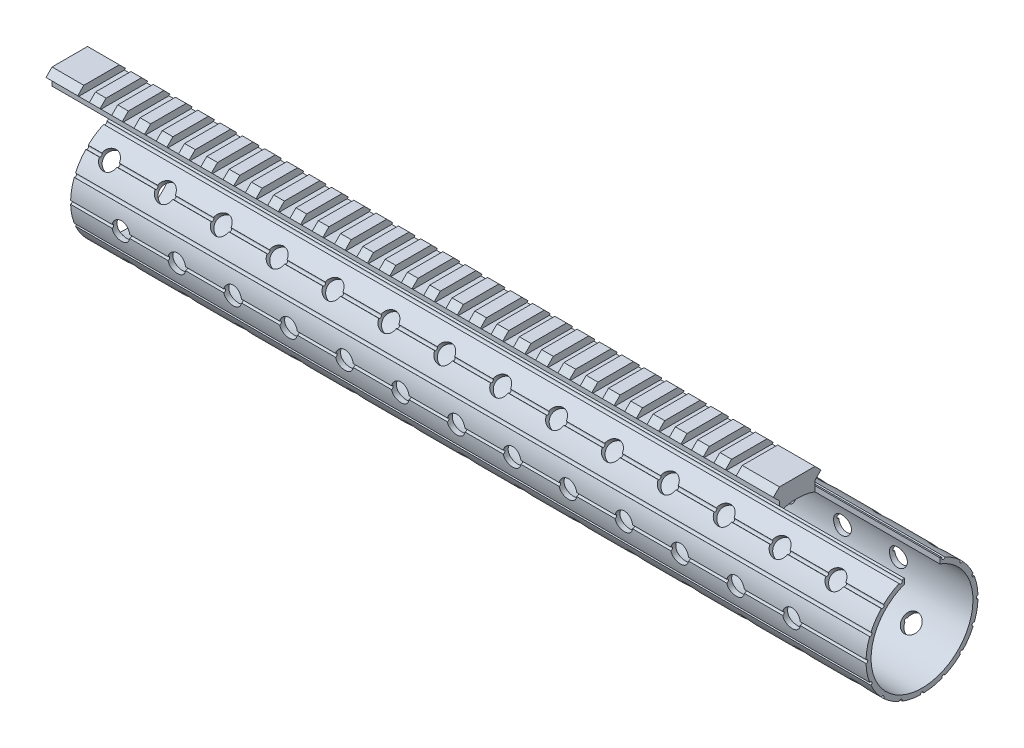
SolidWorks part; units mm, degrees
ref_plane "Front Plane" through (0, 0, 0) normal (0, 0, 1) x (1, 0, 0)
ref_plane "Top Plane" through (0, 0, 0) normal (0, 1, 0) x (1, 0, 0)
ref_plane "Right Plane" through (0, 0, 0) normal (1, 0, 0) x (0, 0, -1)
sketch "Sketch2" plane through (0, 0, 0) normal (0, 0, 1) x (1, 0, 0)
  line L0 (0, 0) -> (20.32, 0) construction
  line L1 (0, 0) -> (462.7626, 0) construction
  line L2 (0, 0) -> (20.32, 0)
  line L3 (0, 0) -> (0, 25.0571)
  line L4 (0, 25.0571) -> (360, 25.0571)
  line L5 (462.7626, 15.0339) -> (462.7626, 17.2945)
  line L6 (360, 25.0571) -> (367.7626, 17.2945)
  line L7 (367.7626, 17.2945) -> (462.7626, 17.2945)
  line L8 (20.32, 0) -> (20.32, 22.7965)
  line L9 (20.32, 22.7965) -> (360, 22.7965)
  line L10 (360, 22.7965) -> (367.7626, 15.0339)
  line L11 (367.7626, 15.0339) -> (462.7626, 15.0339)
  dimension "D1" = 225
  dimension "D2" = 360
  dimension "D3" = 95
revolve "Revolve1" add sketch "Sketch2" angle 360 about L1
fillet "Fillet1" radius 10 2 edges at (360, 0, 25.0571) (367.7626, 0, 17.2945)
sketch "Sketch3" plane through (0, 0, 0) normal (1, 0, 0) x (0, 0, -1)
  circle A1 centre (0, 0) radius 22.7965
  circle A2 centre (0, 0) radius 22.7965
  dimension "D1" = 0
extrude "Cut-Extrude2" cut sketch "Sketch3" along normal blind 25
sketch "Sketch4" plane through (0, 0, 0) normal (0, 0, 1) x (1, 0, 0)
  line L1 (355.8579, 25.0571) -> (470.1858, 25.0571)
  line L2 (355.8579, 25.0571) -> (355.8579, -32.5281)
  line L3 (355.8579, -32.5281) -> (470.1858, -32.5281)
  line L4 (470.1858, 25.0571) -> (470.1858, -32.5281)
extrude "Cut-Extrude4" cut sketch "Sketch4" against normal mid plane 55
sketch "Sketch5" plane through (0, 0, 0) normal (1, 0, 0) x (0, 0, -1)
  line L0 (-7.9375, 23.7667) -> (-7.9375, 25.781)
  line L1 (-7.9375, 25.781) -> (-10.6553, 28.4988)
  line L2 (-10.6553, 28.4988) -> (-7.9375, 31.2166)
  line L3 (-7.9375, 31.2166) -> (7.9375, 31.2166)
  line L4 (7.9375, 31.2166) -> (10.6553, 28.4988)
  line L5 (10.6553, 28.4988) -> (7.9375, 25.781)
  line L6 (7.9375, 25.781) -> (7.9375, 23.7667)
  line L7 (7.9375, 23.7667) -> (7.9375, 22.6778)
  line L8 (7.9375, 22.6778) -> (0, 23.541)
  line L9 (0, 23.541) -> (-7.9375, 22.4476)
  line L10 (-7.9375, 22.4476) -> (-7.9375, 23.7667)
extrude "Boss-Extrude1" add sketch "Sketch5" along normal blind 300
sketch "Sketch6" plane through (0, 0, 0) normal (1, 0, 0) x (0, 0, -1)
  line L0 (-7.9375, 25.781) -> (-7.9375, 23.7667) construction
  line L1 (-10.6553, 28.4988) -> (-7.9375, 25.781) construction
  line L2 (-7.9375, 31.2166) -> (-10.6553, 28.4988) construction
  line L3 (7.9375, 31.2166) -> (-7.9375, 31.2166) construction
  line L4 (10.6553, 28.4988) -> (7.9375, 31.2166) construction
  line L5 (7.9375, 25.781) -> (10.6553, 28.4988) construction
  line L6 (7.9375, 23.7667) -> (7.9375, 25.781) construction
  line L7 (-7.9375, 25.781) -> (-7.9375, 23.7667)
  line L8 (-10.6553, 28.4988) -> (-7.9375, 25.781)
  line L9 (-7.9375, 31.2166) -> (-10.6553, 28.4988)
  line L10 (7.9375, 31.2166) -> (-7.9375, 31.2166)
  line L11 (10.6553, 28.4988) -> (7.9375, 31.2166)
  line L12 (7.9375, 25.781) -> (10.6553, 28.4988)
  line L13 (7.9375, 23.7667) -> (7.9375, 25.781)
  arc A0 (7.9375, 23.7667) -> (-7.9375, 23.7667) centre (0, 0) ccw
extrude "Boss-Extrude2" add sketch "Sketch6" against normal blind 25.4
sketch "Sketch7" plane through (0, 0, 0) normal (0, 0, 1) x (1, 0, 0)
  line L0 (-11.2014, 28.4988) -> (-11.2014, 31.2166)
  line L1 (283.3624, 31.2166) -> (278.5999, 31.2166)
  line L2 (-1.2319, 28.4988) -> (-1.2319, 31.2166)
  line L3 (3.9751, 31.2166) -> (-1.2319, 31.2166)
  line L4 (-5.9944, 31.2166) -> (-5.9944, 28.4988)
  line L5 (8.7376, 28.4988) -> (8.7376, 31.2166)
  line L6 (13.9446, 31.2166) -> (8.7376, 31.2166)
  line L7 (3.9751, 31.2166) -> (3.9751, 28.4988)
  line L8 (18.7071, 28.4988) -> (18.7071, 31.2166)
  line L9 (23.9141, 31.2166) -> (18.7071, 31.2166)
  line L10 (13.9446, 31.2166) -> (13.9446, 28.4988)
  line L11 (283.3624, 31.2166) -> (278.5999, 31.2166)
  line L12 (153.5176, 28.4988) -> (153.5176, 28.0416)
  line L13 (153.5176, 28.0416) -> (148.3106, 28.0416)
  line L14 (148.3106, 28.0416) -> (148.3106, 28.4988)
  line L15 (143.5481, 28.4988) -> (143.5481, 28.0416)
  line L16 (143.5481, 28.0416) -> (138.3411, 28.0416)
  line L17 (138.3411, 28.0416) -> (138.3411, 28.4988)
  line L18 (133.5786, 28.4988) -> (133.5786, 28.0416)
  line L19 (133.5786, 28.0416) -> (128.3716, 28.0416)
  line L20 (128.3716, 28.0416) -> (128.3716, 28.4988)
  line L21 (123.6091, 28.4988) -> (123.6091, 28.0416)
  line L22 (123.6091, 28.0416) -> (118.4021, 28.0416)
  line L23 (118.4021, 28.0416) -> (118.4021, 28.4988)
  line L24 (113.6396, 28.4988) -> (113.6396, 28.0416)
  line L25 (113.6396, 28.0416) -> (108.4326, 28.0416)
  line L26 (108.4326, 28.0416) -> (108.4326, 28.4988)
  line L27 (103.6701, 28.4988) -> (103.6701, 28.0416)
  line L28 (103.6701, 28.0416) -> (98.4631, 28.0416)
  line L29 (98.4631, 28.0416) -> (98.4631, 28.4988)
  line L30 (93.7006, 28.4988) -> (93.7006, 28.0416)
  line L31 (93.7006, 28.0416) -> (88.4936, 28.0416)
  line L32 (88.4936, 28.0416) -> (88.4936, 28.4988)
  line L33 (83.7311, 28.4988) -> (83.7311, 28.0416)
  line L34 (83.7311, 28.0416) -> (78.5241, 28.0416)
  line L35 (78.5241, 28.0416) -> (78.5241, 28.4988)
  line L36 (73.7616, 28.4988) -> (73.7616, 28.0416)
  line L37 (73.7616, 28.0416) -> (68.5546, 28.0416)
  line L38 (68.5546, 28.0416) -> (68.5546, 28.4988)
  line L39 (63.7921, 28.4988) -> (63.7921, 28.0416)
  line L40 (63.7921, 28.0416) -> (58.5851, 28.0416)
  line L41 (58.5851, 28.0416) -> (58.5851, 28.4988)
  line L42 (53.8226, 28.4988) -> (53.8226, 28.0416)
  line L43 (53.8226, 28.0416) -> (48.6156, 28.0416)
  line L44 (48.6156, 28.0416) -> (48.6156, 28.4988)
  line L45 (43.8531, 28.4988) -> (43.8531, 28.0416)
  line L46 (43.8531, 28.0416) -> (38.6461, 28.0416)
  line L47 (38.6461, 28.0416) -> (38.6461, 28.4988)
  line L48 (33.8836, 28.4988) -> (33.8836, 28.0416)
  line L49 (33.8836, 28.0416) -> (28.6766, 28.0416)
  line L50 (28.6766, 28.0416) -> (28.6766, 28.4988)
  line L51 (23.9141, 28.4988) -> (23.9141, 28.0416)
  line L52 (23.9141, 28.0416) -> (18.7071, 28.0416)
  line L53 (18.7071, 28.0416) -> (18.7071, 28.4988)
  line L54 (13.9446, 28.4988) -> (13.9446, 28.0416)
  line L55 (13.9446, 28.0416) -> (8.7376, 28.0416)
  line L56 (8.7376, 28.0416) -> (8.7376, 28.4988)
  line L57 (3.9751, 28.4988) -> (3.9751, 28.0416)
  line L58 (3.9751, 28.0416) -> (-1.2319, 28.0416)
  line L59 (-1.2319, 28.0416) -> (-1.2319, 28.4988)
  line L60 (-5.9944, 28.4988) -> (-5.9944, 28.0416)
  line L61 (-5.9944, 28.0416) -> (-11.2014, 28.0416)
  line L62 (-11.2014, 28.0416) -> (-11.2014, 28.4988)
  line L63 (158.623, 28.4988) -> (158.623, 28.0416)
  line L64 (28.6766, 28.4988) -> (28.6766, 31.2166)
  line L65 (33.8836, 31.2166) -> (28.6766, 31.2166)
  line L66 (23.9141, 31.2166) -> (23.9141, 28.4988)
  line L67 (38.6461, 28.4988) -> (38.6461, 31.2166)
  line L68 (43.8531, 31.2166) -> (38.6461, 31.2166)
  line L69 (33.8836, 31.2166) -> (33.8836, 28.4988)
  line L70 (48.6156, 28.4988) -> (48.6156, 31.2166)
  line L71 (53.8226, 31.2166) -> (48.6156, 31.2166)
  line L72 (43.8531, 31.2166) -> (43.8531, 28.4988)
  line L73 (58.5851, 28.4988) -> (58.5851, 31.2166)
  line L74 (63.7921, 31.2166) -> (58.5851, 31.2166)
  line L75 (53.8226, 31.2166) -> (53.8226, 28.4988)
  line L76 (68.5546, 28.4988) -> (68.5546, 31.2166)
  line L77 (73.7616, 31.2166) -> (68.5546, 31.2166)
  line L78 (63.7921, 31.2166) -> (63.7921, 28.4988)
  line L79 (78.5241, 28.4988) -> (78.5241, 31.2166)
  line L80 (83.7311, 31.2166) -> (78.5241, 31.2166)
  line L81 (73.7616, 31.2166) -> (73.7616, 28.4988)
  line L82 (88.4936, 28.4988) -> (88.4936, 31.2166)
  line L83 (93.7006, 31.2166) -> (88.4936, 31.2166)
  line L84 (83.7311, 31.2166) -> (83.7311, 28.4988)
  line L85 (98.4631, 28.4988) -> (98.4631, 31.2166)
  line L86 (103.6701, 31.2166) -> (98.4631, 31.2166)
  line L87 (93.7006, 31.2166) -> (93.7006, 28.4988)
  line L88 (108.4326, 28.4988) -> (108.4326, 31.2166)
  line L89 (113.6396, 31.2166) -> (108.4326, 31.2166)
  line L90 (103.6701, 31.2166) -> (103.6701, 28.4988)
  line L91 (118.4021, 28.4988) -> (118.4021, 31.2166)
  line L92 (123.6091, 31.2166) -> (118.4021, 31.2166)
  line L93 (113.6396, 31.2166) -> (113.6396, 28.4988)
  line L94 (128.3716, 28.4988) -> (128.3716, 31.2166)
  line L95 (133.5786, 31.2166) -> (128.3716, 31.2166)
  line L96 (123.6091, 31.2166) -> (123.6091, 28.4988)
  line L97 (138.3411, 28.4988) -> (138.3411, 31.2166)
  line L98 (153.5176, 31.2166) -> (148.3106, 31.2166)
  line L99 (133.5786, 31.2166) -> (133.5786, 28.4988)
  line L100 (148.3106, 28.4988) -> (148.3106, 31.2166)
  line L101 (173.6979, 31.2166) -> (168.9354, 31.2166)
  line L102 (143.5481, 31.2166) -> (143.5481, 28.4988)
  line L103 (158.623, 28.4988) -> (158.623, 31.2166)
  line L104 (163.7284, 31.2166) -> (158.623, 31.2166)
  line L105 (153.5176, 31.2166) -> (153.5176, 28.4988)
  line L106 (158.623, 28.0416) -> (163.7284, 28.0416)
  line L107 (-5.9944, 31.2166) -> (-11.2014, 31.2166)
  line L108 (163.7284, 31.2166) -> (163.7284, 28.4988)
  line L109 (173.6979, 31.2166) -> (173.6979, 28.4988)
  line L110 (168.9354, 31.2166) -> (173.6979, 31.2166)
  line L111 (168.9354, 28.4988) -> (168.9354, 31.2166)
  line L112 (183.6674, 31.2166) -> (183.6674, 28.4988)
  line L113 (178.9049, 31.2166) -> (183.6674, 31.2166)
  line L114 (178.9049, 28.4988) -> (178.9049, 31.2166)
  line L115 (193.6369, 31.2166) -> (193.6369, 28.4988)
  line L116 (188.8744, 31.2166) -> (193.6369, 31.2166)
  line L117 (188.8744, 28.4988) -> (188.8744, 31.2166)
  line L118 (203.6064, 31.2166) -> (203.6064, 28.4988)
  line L119 (198.8439, 31.2166) -> (203.6064, 31.2166)
  line L120 (198.8439, 28.4988) -> (198.8439, 31.2166)
  line L121 (213.5759, 31.2166) -> (213.5759, 28.4988)
  line L122 (208.8134, 31.2166) -> (213.5759, 31.2166)
  line L123 (208.8134, 28.4988) -> (208.8134, 31.2166)
  line L124 (223.5454, 31.2166) -> (223.5454, 28.4988)
  line L125 (218.7829, 31.2166) -> (223.5454, 31.2166)
  line L126 (218.7829, 28.4988) -> (218.7829, 31.2166)
  line L127 (233.5149, 31.2166) -> (233.5149, 28.4988)
  line L128 (228.7524, 31.2166) -> (233.5149, 31.2166)
  line L129 (228.7524, 28.4988) -> (228.7524, 31.2166)
  line L130 (243.4844, 31.2166) -> (243.4844, 28.4988)
  line L131 (238.7219, 31.2166) -> (243.4844, 31.2166)
  line L132 (238.7219, 28.4988) -> (238.7219, 31.2166)
  line L133 (253.4539, 31.2166) -> (253.4539, 28.4988)
  line L134 (248.6914, 31.2166) -> (253.4539, 31.2166)
  line L135 (248.6914, 28.4988) -> (248.6914, 31.2166)
  line L136 (263.4234, 31.2166) -> (263.4234, 28.4988)
  line L137 (258.6609, 31.2166) -> (263.4234, 31.2166)
  line L138 (258.6609, 28.4988) -> (258.6609, 31.2166)
  line L139 (273.3929, 31.2166) -> (273.3929, 28.4988)
  line L140 (268.6304, 31.2166) -> (273.3929, 31.2166)
  line L141 (268.6304, 28.4988) -> (268.6304, 31.2166)
  line L142 (283.3624, 31.2166) -> (283.3624, 28.4988)
  line L143 (278.5999, 31.2166) -> (283.3624, 31.2166)
  line L144 (278.5999, 28.4988) -> (278.5999, 31.2166)
  line L145 (-5.9944, 31.2166) -> (-11.2014, 31.2166)
  line L146 (3.9751, 31.2166) -> (-1.2319, 31.2166)
  line L148 (13.9446, 31.2166) -> (8.7376, 31.2166)
  line L149 (23.9141, 31.2166) -> (18.7071, 31.2166)
  line L150 (33.8836, 31.2166) -> (28.6766, 31.2166)
  line L151 (43.8531, 31.2166) -> (38.6461, 31.2166)
  line L152 (53.8226, 31.2166) -> (48.6156, 31.2166)
  line L153 (63.7921, 31.2166) -> (58.5851, 31.2166)
  line L154 (73.7616, 31.2166) -> (68.5546, 31.2166)
  line L155 (83.7311, 31.2166) -> (78.5241, 31.2166)
  line L156 (93.7006, 31.2166) -> (88.4936, 31.2166)
  line L157 (103.6701, 31.2166) -> (98.4631, 31.2166)
  line L158 (113.6396, 31.2166) -> (108.4326, 31.2166)
  line L159 (123.6091, 31.2166) -> (118.4021, 31.2166)
  line L162 (283.3624, 28.4988) -> (283.3624, 28.0416)
  line L163 (278.5999, 28.0416) -> (278.5999, 28.4988)
  line L165 (273.3929, 28.4988) -> (273.3929, 28.0416)
  line L166 (268.6304, 28.0416) -> (268.6304, 28.4988)
  line L167 (273.3929, 31.2166) -> (268.6304, 31.2166)
  line L168 (263.4234, 28.4988) -> (263.4234, 28.0416)
  line L169 (258.6609, 28.0416) -> (258.6609, 28.4988)
  line L170 (263.4234, 31.2166) -> (258.6609, 31.2166)
  line L171 (253.4539, 28.4988) -> (253.4539, 28.0416)
  line L172 (248.6914, 28.0416) -> (248.6914, 28.4988)
  line L173 (253.4539, 31.2166) -> (248.6914, 31.2166)
  line L174 (243.4844, 28.4988) -> (243.4844, 28.0416)
  line L175 (238.7219, 28.0416) -> (238.7219, 28.4988)
  line L176 (243.4844, 31.2166) -> (238.7219, 31.2166)
  line L177 (233.5149, 28.4988) -> (233.5149, 28.0416)
  line L178 (228.7524, 28.0416) -> (228.7524, 28.4988)
  line L179 (233.5149, 31.2166) -> (228.7524, 31.2166)
  line L180 (223.5454, 28.4988) -> (223.5454, 28.0416)
  line L181 (218.7829, 28.0416) -> (218.7829, 28.4988)
  line L182 (223.5454, 31.2166) -> (218.7829, 31.2166)
  line L183 (213.5759, 28.4988) -> (213.5759, 28.0416)
  line L184 (208.8134, 28.0416) -> (208.8134, 28.4988)
  line L185 (213.5759, 31.2166) -> (208.8134, 31.2166)
  line L186 (203.6064, 28.4988) -> (203.6064, 28.0416)
  line L187 (198.8439, 28.0416) -> (198.8439, 28.4988)
  line L188 (203.6064, 31.2166) -> (198.8439, 31.2166)
  line L189 (193.6369, 28.4988) -> (193.6369, 28.0416)
  line L190 (188.8744, 28.0416) -> (188.8744, 28.4988)
  line L191 (193.6369, 31.2166) -> (188.8744, 31.2166)
  line L192 (183.6674, 28.4988) -> (183.6674, 28.0416)
  line L193 (178.9049, 28.0416) -> (178.9049, 28.4988)
  line L194 (183.6674, 31.2166) -> (178.9049, 31.2166)
  line L195 (173.6979, 28.4988) -> (173.6979, 28.0416)
  line L196 (168.9354, 28.0416) -> (168.9354, 28.4988)
  line L198 (163.7284, 28.4988) -> (163.7284, 28.0416)
  line L199 (133.5786, 31.2166) -> (128.3716, 31.2166)
  line L200 (143.5481, 31.2166) -> (138.3411, 31.2166)
  line L201 (143.5481, 31.2166) -> (138.3411, 31.2166)
  line L202 (153.5176, 31.2166) -> (148.3106, 31.2166)
  line L203 (163.7284, 31.2166) -> (158.623, 31.2166)
  line L204 (163.7284, 31.2166) -> (158.623, 31.2166)
  line L205 (168.9354, 28.0416) -> (173.6979, 28.0416)
  line L206 (173.6979, 31.2166) -> (168.9354, 31.2166)
  line L207 (178.9049, 28.0416) -> (183.6674, 28.0416)
  line L208 (183.6674, 31.2166) -> (178.9049, 31.2166)
  line L209 (188.8744, 28.0416) -> (193.6369, 28.0416)
  line L210 (193.6369, 31.2166) -> (188.8744, 31.2166)
  line L211 (198.8439, 28.0416) -> (203.6064, 28.0416)
  line L212 (203.6064, 31.2166) -> (198.8439, 31.2166)
  line L213 (208.8134, 28.0416) -> (213.5759, 28.0416)
  line L214 (213.5759, 31.2166) -> (208.8134, 31.2166)
  line L215 (218.7829, 28.0416) -> (223.5454, 28.0416)
  line L216 (223.5454, 31.2166) -> (218.7829, 31.2166)
  line L217 (228.7524, 28.0416) -> (233.5149, 28.0416)
  line L218 (233.5149, 31.2166) -> (228.7524, 31.2166)
  line L219 (238.7219, 28.0416) -> (243.4844, 28.0416)
  line L220 (243.4844, 31.2166) -> (238.7219, 31.2166)
  line L221 (248.6914, 28.0416) -> (253.4539, 28.0416)
  line L222 (253.4539, 31.2166) -> (248.6914, 31.2166)
  line L223 (258.6609, 28.0416) -> (263.4234, 28.0416)
  line L224 (263.4234, 31.2166) -> (258.6609, 31.2166)
  line L225 (268.6304, 28.0416) -> (273.3929, 28.0416)
  line L226 (273.3929, 31.2166) -> (268.6304, 31.2166)
  line L227 (278.5999, 28.0416) -> (283.3624, 28.0416)
extrude "Cut-Extrude5" cut sketch "Sketch7" against normal mid plane 25.4 contours L4 L107 L0 L62 L61 L60 | L59 L58 L57 L7 L3 L2 | L56 L55 L54 L10 L6 L5 | L66 L9 L8 L53 L52 L51 | L69 L65 L64 L50 L49 L48 | L72 L68 L67 L47 L46 L45 | L75 L71 L70 L44 L43 L42 | L78 L74 L73 L41 L40 L39 | L81 L77 L76 L38 L37 L36 | L84 L80 L79 L35 L34 L33 | L87 L83 L82 L32 L31 L30 | L90 L86 L85 L29 L28 L27 | L93 L89 L88 L26 L25 L24 | L96 L92 L91 L23 L22 L21 | L99 L95 L94 L20 L19 L18 | L102 L200 L97 L17 L16 L15 | L105 L98 L100 L14 L13 L12 | L198 L108 L104 L103 L63 L106 | L196 L205 L195 L109 L101 L111 | L193 L207 L192 L112 L113 L114 | L190 L209 L189 L115 L116 L117 | L187 L211 L186 L118 L119 L120 | L184 L213 L183 L121 L122 L123 | L181 L215 L180 L124 L125 L126 | L178 L217 L177 L127 L128 L129 | L175 L219 L174 L130 L131 L132 | L172 L221 L171 L133 L134 L135 | L169 L223 L168 L136 L137 L138 | L166 L225 L165 L139 L140 L141 | L163 L227 L162 L142 L1 L144
sketch "Sketch8" plane through (0, 0, 0) normal (1, 0, 0) x (0, 0, -1)
  line L0 (-17.1618, 17.1618) -> (-17.718, 17.718) construction
  line L1 (0, 0) -> (-7.8384, 0) construction
  circle A0 centre (0, 0) radius 25.0571 construction
  arc A1 (-10.2772, 22.8525) -> (-8.8921, 23.4262) centre (-9.5749, 23.1158) ccw
  arc A2 (-18.2401, 17.1801) -> (-17.1801, 18.2401) centre (-17.6921, 17.6921) ccw
  arc A3 (-8.8921, 23.4262) -> (-10.2772, 22.8525) centre (0, 0) ccw
  arc A4 (8.8921, 23.4262) -> (10.2772, 22.8525) centre (9.5749, 23.1158) ccw
  arc A5 (17.1801, 18.2401) -> (18.2401, 17.1801) centre (17.6921, 17.6921) ccw
  arc A6 (22.8525, 10.2772) -> (23.4262, 8.8921) centre (23.1158, 9.5749) ccw
  arc A7 (25.0459, 0.7496) -> (25.0459, -0.7496) centre (25.0204, 0) ccw
  arc A8 (23.4262, -8.8921) -> (22.8525, -10.2772) centre (23.1158, -9.5749) ccw
  arc A9 (18.2401, -17.1801) -> (17.1801, -18.2401) centre (17.6921, -17.6921) ccw
  arc A10 (10.2772, -22.8525) -> (8.8921, -23.4262) centre (9.5749, -23.1158) ccw
  arc A11 (0.7496, -25.0459) -> (-0.7496, -25.0459) centre (0, -25.0204) ccw
  arc A12 (-8.8921, -23.4262) -> (-10.2772, -22.8525) centre (-9.5749, -23.1158) ccw
  arc A13 (-17.1801, -18.2401) -> (-18.2401, -17.1801) centre (-17.6921, -17.6921) ccw
  arc A14 (-22.8525, -10.2772) -> (-23.4262, -8.8921) centre (-23.1158, -9.5749) ccw
  arc A15 (-25.0459, -0.7496) -> (-25.0459, 0.7496) centre (-25.0204, 0) ccw
  arc A16 (-23.4262, 8.8921) -> (-22.8525, 10.2772) centre (-23.1158, 9.5749) ccw
  arc A17 (10.2772, 22.8525) -> (8.8921, 23.4262) centre (0, 0) ccw
  arc A18 (18.2401, 17.1801) -> (17.1801, 18.2401) centre (0, 0) ccw
  arc A19 (23.4262, 8.8921) -> (22.8525, 10.2772) centre (0, 0) ccw
  arc A20 (25.0459, -0.7496) -> (25.0459, 0.7496) centre (0, 0) ccw
  arc A21 (22.8525, -10.2772) -> (23.4262, -8.8921) centre (0, 0) ccw
  arc A22 (17.1801, -18.2401) -> (18.2401, -17.1801) centre (0, 0) ccw
  arc A23 (8.8921, -23.4262) -> (10.2772, -22.8525) centre (0, 0) ccw
  arc A24 (-0.7496, -25.0459) -> (0.7496, -25.0459) centre (0, 0) ccw
  arc A25 (-10.2772, -22.8525) -> (-8.8921, -23.4262) centre (0, 0) ccw
  arc A26 (-18.2401, -17.1801) -> (-17.1801, -18.2401) centre (0, 0) ccw
  arc A27 (-23.4262, -8.8921) -> (-22.8525, -10.2772) centre (0, 0) ccw
  arc A28 (-25.0459, 0.7496) -> (-25.0459, -0.7496) centre (0, 0) ccw
  arc A29 (-22.8525, 10.2772) -> (-23.4262, 8.8921) centre (0, 0) ccw
  arc A30 (-17.1801, 18.2401) -> (-18.2401, 17.1801) centre (0, 0) ccw
  arc A49 (-0.7496, 25.0459) -> (0.7496, 25.0459) centre (0, 25.0204) ccw
  point P1 (0, 0)
  point P2 (0, 0)
  point P3 (0, 0)
  point P4 (0, 0)
  point P7 (0, 0)
  point P8 (0, 0)
  point P9 (0, 0)
  point P10 (0, 0)
  point P11 (0, 0)
  point P13 (0, 0)
  point P14 (0, 0)
  point P15 (0, 0)
  point P16 (0, 0)
  point P17 (0, 0)
  point P19 (0, 0)
  point P23 (-17.1618, 17.1618)
  point P31 (-9.2879, 22.4229)
  point P35 (0, 24.2704)
  point P39 (9.2879, 22.4229)
  point P43 (17.1618, 17.1618)
  point P47 (22.4229, 9.2879)
  point P51 (24.2704, 0)
  point P55 (22.4229, -9.2879)
  point P59 (17.1618, -17.1618)
  point P63 (9.2879, -22.4229)
  point P67 (0, -24.2704)
  point P71 (-9.2879, -22.4229)
  point P75 (-17.1618, -17.1618)
  point P79 (-22.4229, -9.2879)
  point P83 (-24.2704, 0)
  point P87 (-22.4229, 9.2879)
  point P88 (0, 0)
  dimension "D2" = 0.75
  dimension "D1" = 45
sketch "Sketch9" plane through (0, 0, 0) normal (1, 0, 0) x (0, 0, -1)
  line L0 (-38.0567, 11.5746) -> (-38.0567, -10.6148)
  line L1 (-38.0567, -10.6148) -> (-12.1566, -36.5149)
  line L2 (-38.0567, 11.5746) -> (-12.1566, 37.4747)
  line L3 (0, 0) -> (-38.0567, 38.0567) construction
  line L4 (0, 0) -> (-73.9335, 0) construction
  line L5 (0, 0) -> (-50.2545, -50.2545) construction
ref_plane "Plane1" through (0, 17.718, -17.718) normal (0, 0.7071, -0.7071) x (1, 0, 0)
sketch "Sketch10" plane through (0, 17.718, -17.718) normal (0, 0.7071, -0.7071) x (1, 0, 0)
  line L0 (355.8579, 0) -> (-21.8989, 0) construction
  line L1 (355.8579, -25.0571) -> (355.8579, 25.0571) construction
  line L2 (330.8579, 0) -> (-46.8989, 0) construction
  line L3 (305.8579, 0) -> (-71.8989, 0) construction
  line L4 (280.8579, 0) -> (-96.8989, 0) construction
  line L5 (255.8579, 0) -> (-121.8989, 0) construction
  line L6 (230.8579, 0) -> (-146.8989, 0) construction
  line L7 (205.8579, 0) -> (-171.8989, 0) construction
  line L8 (180.8579, 0) -> (-196.8989, 0) construction
  line L9 (155.8579, 0) -> (-221.8989, 0) construction
  line L10 (130.8579, 0) -> (-246.8989, 0) construction
  line L11 (105.8579, 0) -> (-271.8989, 0) construction
  line L12 (80.8579, 0) -> (-296.8989, 0) construction
  line L13 (55.8579, 0) -> (-321.8989, 0) construction
  line L14 (30.8579, 0) -> (-346.8989, 0) construction
  circle A0 centre (345.8579, 0) radius 4
  circle A1 centre (320.8579, 0) radius 4
  circle A2 centre (295.8579, 0) radius 4
  circle A3 centre (270.8579, 0) radius 4
  circle A4 centre (245.8579, 0) radius 4
  circle A5 centre (220.8579, 0) radius 4
  circle A6 centre (195.8579, 0) radius 4
  circle A7 centre (170.8579, 0) radius 4
  circle A8 centre (145.8579, 0) radius 4
  circle A9 centre (120.8579, 0) radius 4
  circle A10 centre (95.8579, 0) radius 4
  circle A11 centre (70.8579, 0) radius 4
  circle A12 centre (45.8579, 0) radius 4
  circle A13 centre (20.8579, 0) radius 4
  point P5 (0, 0)
  dimension "D1" = 8
  dimension "D2" = 10
  dimension "D3" = 14
extrude "Cut-Extrude7" cut sketch "Sketch10" against normal through all
sketch "Sketch11" plane through (0, 0, 0) normal (0, 0, 1) x (1, 0, 0)
  circle A0 centre (22.5, 0) radius 4
  circle A1 centre (47.5, 0) radius 4
  circle A2 centre (72.5, 0) radius 4
  circle A3 centre (97.5, 0) radius 4
  circle A4 centre (122.5, 0) radius 4
  circle A5 centre (147.5, 0) radius 4
  circle A6 centre (172.5, 0) radius 4
  circle A7 centre (197.5, 0) radius 4
  circle A8 centre (222.5, 0) radius 4
  circle A9 centre (247.5, 0) radius 4
  circle A10 centre (272.5, 0) radius 4
  circle A11 centre (297.5, 0) radius 4
  circle A12 centre (322.5, 0) radius 4
  dimension "D1" = 8
  dimension "D2" = 22.5
ref_plane "Plane2" through (0, 19.577, 19.577) normal (0, -0.7071, -0.7071) x (-1, 0, 0)
sketch "Sketch12" plane through (0, 19.577, 19.577) normal (0, -0.7071, -0.7071) x (-1, 0, 0)
  circle A0 centre (-10, 0) radius 4
  circle A1 centre (-35, 0) radius 4
  circle A2 centre (-60, 0) radius 4
  circle A3 centre (-85, 0) radius 4
  circle A4 centre (-110, 0) radius 4
  circle A5 centre (-135, 0) radius 4
  circle A6 centre (-160, 0) radius 4
  circle A7 centre (-185, 0) radius 4
  circle A8 centre (-210, 0) radius 4
  circle A9 centre (-235, 0) radius 4
  circle A10 centre (-260, 0) radius 4
  circle A11 centre (-285, 0) radius 4
  circle A12 centre (-310, 0) radius 4
  circle A13 centre (-335, 0) radius 4
  dimension "D2" = 8
  dimension "D1" = 10
  dimension "D3" = 14
extrude "Cut-Extrude9" cut sketch "Sketch12" along normal through all
extrude "Cut-Extrude10" cut sketch "Sketch11" against normal mid plane 60
extrude "Cut-Extrude11" cut sketch "Sketch8" along normal through all
ref_plane "Plane3" through (355.8579, 0, 0) normal (1, 0, 0) x (0, 0, -1)
sketch "Sketch13" plane through (355.8579, 0, 0) normal (1, 0, 0) x (0, 0, -1)
  line L0 (-7.9375, 25.781) -> (-7.9375, 18.0171)
  line L1 (-7.9375, 18.0171) -> (7.9375, 18.0171)
  line L2 (7.9375, 25.781) -> (7.9375, 18.0171)
  line L3 (-7.9375, 25.781) -> (7.9375, 25.781)
extrude "Cut-Extrude12" cut sketch "Sketch13" against normal up to surface (55.8579 mm away)
